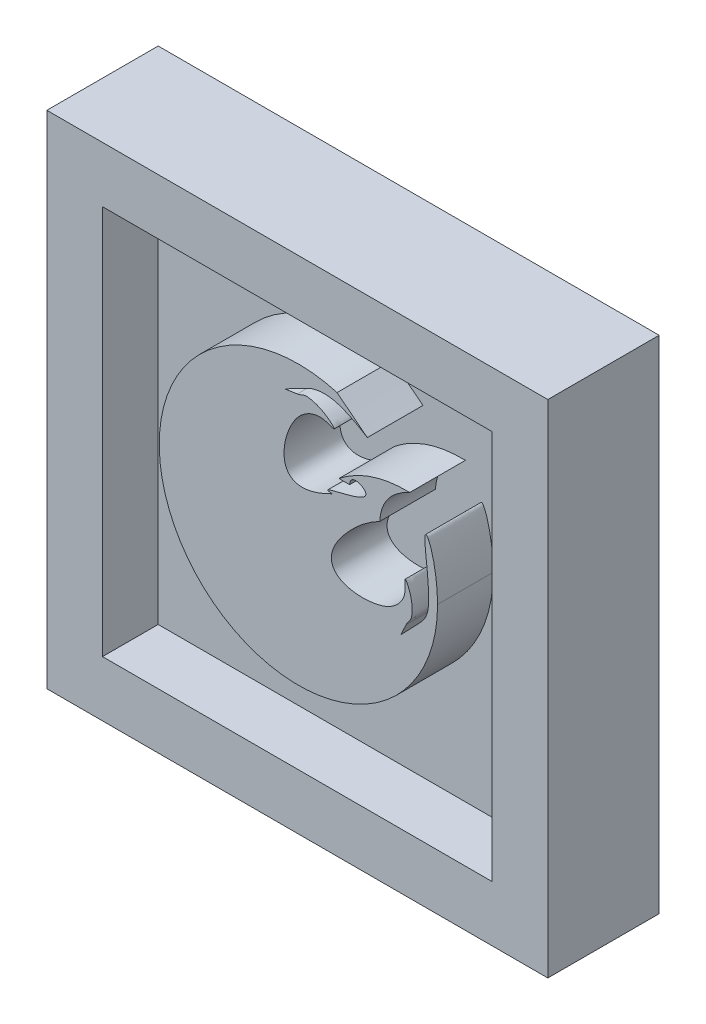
SolidWorks part; units mm, degrees
ref_plane "Front Plane" through (0, 0, 0) normal (0, 0, 1) x (1, 0, 0)
ref_plane "Top Plane" through (0, 0, 0) normal (0, 1, 0) x (1, 0, 0)
ref_plane "Right Plane" through (0, 0, 0) normal (1, 0, 0) x (0, 0, -1)
sketch "Sketch1" plane through (0, 0, 0) normal (0, 0, 1) x (1, 0, 0)
  line L1 (-45, -45) -> (45, -45)
  line L2 (-45, -45) -> (-45, 45)
  line L3 (-45, 45) -> (45, 45)
  line L4 (45, -45) -> (45, 45)
  line L5 (-45, -45) -> (45, 45) construction
  line L6 (-45, 45) -> (45, -45) construction
  point P0 (0, 0)
  dimension "D1" = 90
  dimension "D2" = 90
extrude "Boss-Extrude1" add sketch "Sketch1" along normal blind 20
shell "Shell1" thickness 10
sketch "Sketch3" plane through (0, 0, 10) normal (0, 0, 1) x (1, 0, 0)
  line L0 (7.4777, 13.9518) -> (9.3926, 13.9518)
  line L1 (21.802, -1.4586) -> (18.6037, -4.7838)
  line L2 (1.8319, 25.1682) -> (-2.2558, 23.0288)
  line L3 (-2.2558, 23.0288) -> (0.19, 23.3985)
  line L4 (18.6037, -4.7838) -> (19.6433, -2.5394)
  arc A0 (7.1336, 27.1509) -> (25.1899, 3.208) centre (0.19, 3.1345) ccw
  spline S0 degree 3 poles (7.1336, 27.1509) (17.0731, 19.1477) (8.7427, 26.9549) (2.9448, 25.7221) (1.8319, 25.1682) knots 0 0 0 0 0.174434 0.248801 0.248801 0.248801 0.248801
  spline S1 degree 3 poles (25.1899, 3.208) (25.1889, 3.5302) (25.0462, 9.6965) (21.6124, 17.7555) (24.5934, 1.1856) (22.6454, -0.5453) (21.802, -1.4586) knots 0 0 0 0 0.004404 0.088087 0.174434 0.248801 0.248801 0.248801 0.248801
  spline S2 degree 2 poles (20.19, 18.1345) (12.9378, 18.2885) (7.4777, 13.9518) knots 0 0 0 1 1 1
  spline S3 degree 3 poles (9.3926, 13.9518) (9.4995, 16.0461) (13.3767, 14.4041) (10.3429, 11.9904) (3.4265, 11.2162) (6.2456, 10.9544) knots 0 0 0 0 0.343546 0.483229 1 1 1 1
  spline S4 degree 2 poles (20.19, 18.1345) (15.0615, 15.7823) (14.8148, 10.9544) knots 0 0 0 1 1 1
  spline S5 degree 2 poles (14.8148, 10.9544) (11.745, 9.3319) (9.3926, 6.7584) knots 0 0 0 1 1 1
  spline S6 degree 3 poles (0.0034, 23.3703) (0.0664, 23.3757) (0.4849, 23.439) (1.3265, 23.9828) (2.8872, 23.6559) (4.9491, 22.9532) (7.416, 20.8185) (5.8491, 21.4696) (3.8079, 22.0283) (0.8759, 21.0854) (-3.5008, 15.0425) (-3.2307, 6.099) (6.2456, 10.9544) knots 0.337694 0.337694 0.337694 0.337694 0.341426 0.362746 0.394757 0.429544 0.500579 0.540544 0.562561 0.621531 0.710491 1 1 1 1
  spline S7 degree 3 poles (19.564, -2.7106) (19.5869, -2.6517) (19.7649, -2.2676) (20.5225, -1.6119) (20.6457, -0.0221) (20.5485, 2.1541) (19.1898, 5.1201) (19.3762, 3.4335) (19.341, 1.3175) (17.6149, -1.2332) (10.5882, -3.7428) (2.0781, -0.9794) (9.3926, 6.7584) knots 0.337694 0.337694 0.337694 0.337694 0.341426 0.362746 0.394757 0.429544 0.500579 0.540544 0.562561 0.621531 0.710491 1 1 1 1
  point P0 (0.1384, 2.7822)
extrude "Boss-Extrude2" add sketch "Sketch3" along normal blind 10 contours L4 S7 S5 S4 S2 L0 S3 S6 L3 L2 S0 A0 S1 L1
